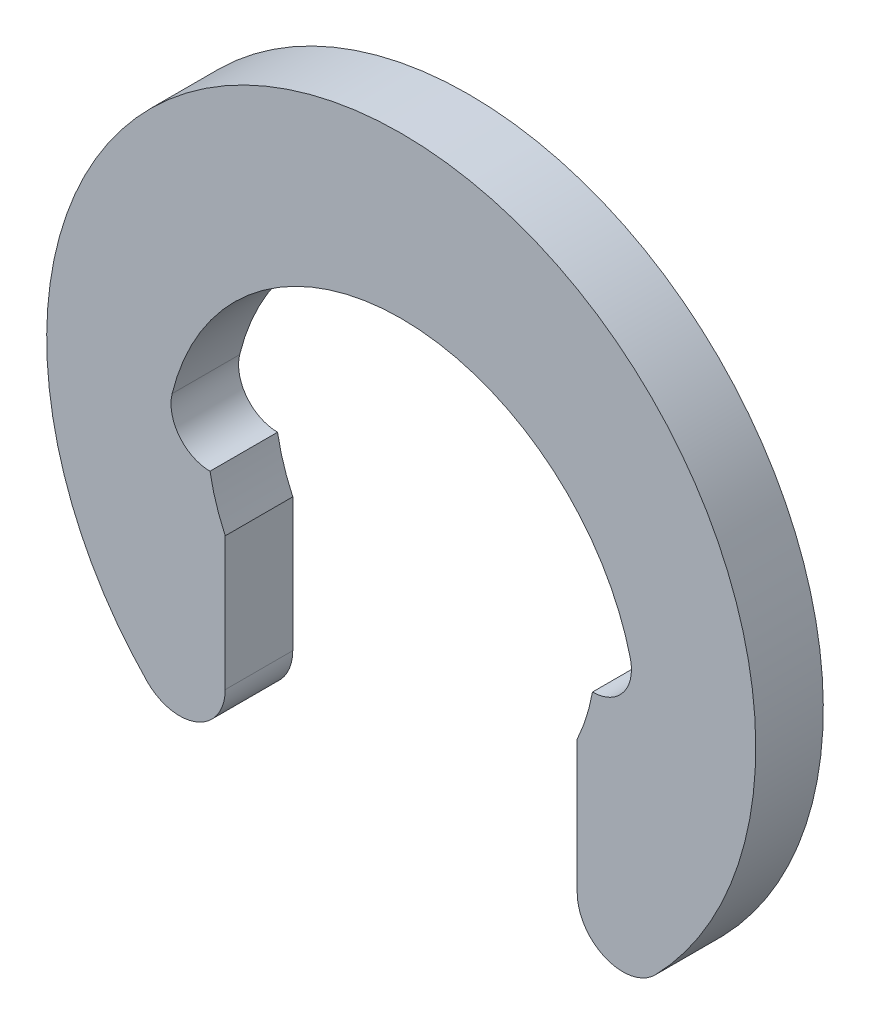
SolidWorks part; units mm, degrees
ref_plane "Plane1" through (0, 0, 0) normal (0, 0, 1) x (1, 0, 0)
ref_plane "Plane2" through (0, 0, 0) normal (0, 1, 0) x (1, 0, 0)
ref_plane "Plane3" through (0, 0, 0) normal (1, 0, 0) x (0, 0, -1)
sketch "Clipboard" plane through (0, 0, 0) normal (0, 0, 1) x (1, 0, 0)
  line L0 (0, 0) -> (0.9, 0)
  circle A0 centre (0, 0) radius 1.09
  circle A1 centre (0, 0) radius 1.99
  dimension "FreeID" = 2.18
  dimension "FreeOD" = 3.98
  dimension "LargeSection" = 0.9
sketch "BodySke" plane through (0, 0, 0) normal (0, 0, 1) x (1, 0, 0)
  line L0 (-1.375, 0) -> (1.375, 0) construction
  line L1 (0, 0) -> (0, 1.15) construction
  line L2 (0, 0) -> (1.1325, -0.1997) construction
  line L3 (0, 0) -> (1.0423, -0.486) construction
  line L4 (0, 0) -> (-1.1325, -0.1997) construction
  line L5 (0, 0) -> (-1.0423, -0.486) construction
  line L6 (1.0423, -0.486) -> (1.0423, -1.2748)
  line L7 (-1.0423, -0.486) -> (-1.0423, -1.2748)
  circle A0 centre (0, 0) radius 1.15 construction
  arc A1 (1.375, 0) -> (-1.375, 0) centre (0, -0.247) ccw construction
  arc A2 (1.5059, -1.463) -> (-1.5059, -1.463) centre (0, 0) ccw
  arc A3 (1.0423, -0.486) -> (1.1325, -0.1997) centre (0, 0) ccw
  arc A4 (1.3567, 0.0862) -> (-1.3567, 0.0862) centre (0, -0.247) ccw
  arc A5 (-1.1325, -0.1997) -> (-1.0423, -0.486) centre (0, 0) ccw
  arc A6 (1.1325, -0.1997) -> (1.3567, 0.0862) centre (1.1325, 0.0311) ccw
  arc A7 (-1.3567, 0.0862) -> (-1.1325, -0.1997) centre (-1.1325, 0.0311) ccw
  arc A8 (1.0423, -1.2748) -> (1.5059, -1.463) centre (1.3123, -1.2748) ccw
  arc A9 (-1.5059, -1.463) -> (-1.0423, -1.2748) centre (-1.3123, -1.2748) ccw
  dimension "D1" = 10
  dimension "GrooveDia" = 2.3
  dimension "OutsideDia" = 4.1991
  dimension "TipRad" = 0.27
  dimension "CavityWidth" = 2.75
  dimension "D2" = 15
extrude "Body" add sketch "BodySke" against normal blind 0.4
equation "' \"FreeID@Clipboard\" = 2.18"
equation "' \"Thickness@Body\" = 0.4"
equation "' \"GrooveDia@BodySke\" = 2.3"
equation "' \"FreeOD@Clipboard\" = 3.98"
equation "' \"LargeSection@Clipboard\" = 0.9"
equation "\"OutsideDia@BodySke\" = ( \"GrooveDia@BodySke\"  /  \"FreeID@Clipboard\" )  * \"FreeOD@Clipboard\""
equation "\"CavityWidth@BodySke\" = \"GrooveDia@BodySke\" + 0.25 * 2 * \"LargeSection@Clipboard\""
equation "\"TipRad@BodySke\" = 0.3 * \"LargeSection@Clipboard\""
